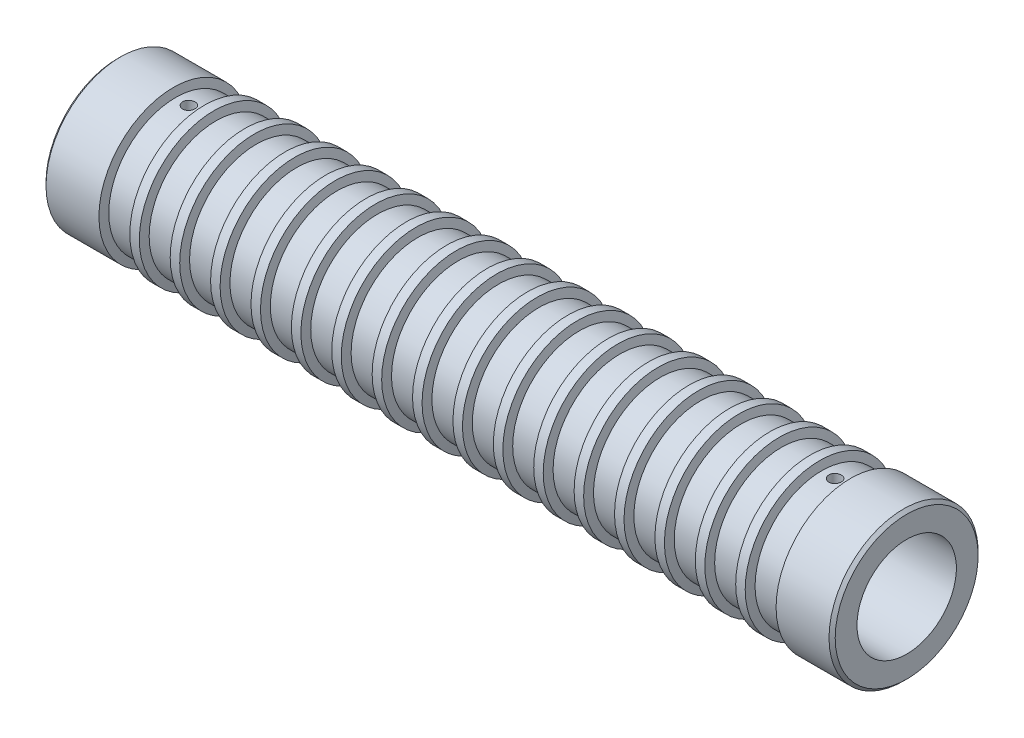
SolidWorks part; units mm, degrees
ref_plane "Ebene1" through (0, 0, 0) normal (0, 0, 1) x (1, 0, 0)
ref_plane "Ebene2" through (0, 0, 0) normal (0, 1, 0) x (1, 0, 0)
ref_plane "Ebene3" through (0, 0, 0) normal (1, 0, 0) x (0, 0, -1)
sketch "Skizze1" plane through (0, 0, 0) normal (0, 0, 1) x (1, 0, 0)
  line L0 (-63.5, 0) -> (63.5, 0) construction
  line L1 (-63, 12) -> (-63.5, 11.5)
  line L2 (54.15, 10.75) -> (49.85, 10.75)
  line L3 (-47.5, 8) -> (-47.5, 7.5)
  line L4 (-47.5, 7.5) -> (47.5, 7.5)
  line L5 (47.5, 7.5) -> (47.5, 8)
  line L6 (-47.9849, 12) -> (-47.65, 10.75)
  line L7 (0, 0) -> (0, 33.3198) construction
  line L10 (63.5, 8) -> (63.5, 11.5)
  line L11 (-63.5, 8) -> (-63.5, 11.5)
  line L12 (54.4849, 12) -> (63, 12)
  line L13 (54.4849, 12) -> (54.15, 10.75)
  line L14 (49.5151, 12) -> (49.85, 10.75)
  line L15 (52, 33.3198) -> (52, 10.75) construction
  line L16 (49.5151, 12) -> (47.9849, 12)
  line L17 (41.4849, 12) -> (41.15, 10.75)
  line L18 (36.5151, 12) -> (36.85, 10.75)
  line L19 (39, 33.3198) -> (39, 10.75) construction
  line L20 (41.15, 10.75) -> (36.85, 10.75)
  line L21 (36.5151, 12) -> (34.9849, 12)
  line L22 (-26, 10.75) -> (-26, 33.3198) construction
  line L23 (28.4849, 12) -> (28.15, 10.75)
  line L24 (23.5151, 12) -> (23.85, 10.75)
  line L25 (26, 33.3198) -> (26, 10.75) construction
  line L26 (28.15, 10.75) -> (23.85, 10.75)
  line L27 (23.5151, 12) -> (21.9849, 12)
  line L29 (63, 12) -> (63.5, 11.5)
  line L30 (-2.4849, 12) -> (-2.15, 10.75)
  line L31 (-2.15, 10.75) -> (2.15, 10.75)
  line L32 (10.5151, 12) -> (8.9849, 12)
  line L33 (-54.4849, 12) -> (-54.15, 10.75)
  line L34 (-54.15, 10.75) -> (-49.85, 10.75)
  line L35 (-49.5151, 12) -> (-49.85, 10.75)
  line L36 (-41.4849, 12) -> (-41.15, 10.75)
  line L37 (-41.15, 10.75) -> (-36.85, 10.75)
  line L38 (-36.5151, 12) -> (-36.85, 10.75)
  line L39 (-28.4849, 12) -> (-28.15, 10.75)
  line L40 (-28.15, 10.75) -> (-23.85, 10.75)
  line L41 (-23.5151, 12) -> (-23.85, 10.75)
  line L42 (2.15, 10.75) -> (2.4849, 12)
  line L43 (-28.4849, 12) -> (-30.0151, 12)
  line L44 (-41.4849, 12) -> (-43.0151, 12)
  line L45 (-54.4849, 12) -> (-63, 12)
  line L46 (-39, 10.75) -> (-39, 33.3198) construction
  line L47 (-52, 10.75) -> (-52, 33.3198) construction
  line L49 (-63.5, 8) -> (-47.5, 8)
  line L59 (47.5, 8) -> (63.5, 8)
  line L60 (-47.65, 10.75) -> (-43.35, 10.75)
  line L62 (-43.35, 10.75) -> (-43.0151, 12)
  line L63 (-34.9849, 12) -> (-34.65, 10.75)
  line L64 (-34.65, 10.75) -> (-30.35, 10.75)
  line L65 (-30.35, 10.75) -> (-30.0151, 12)
  line L66 (13, 33.3198) -> (13, 10.75) construction
  line L67 (-21.9849, 12) -> (-21.65, 10.75)
  line L68 (-21.65, 10.75) -> (-17.35, 10.75)
  line L69 (-17.35, 10.75) -> (-17.0151, 12)
  line L70 (-8.9849, 12) -> (-8.65, 10.75)
  line L71 (-8.65, 10.75) -> (-4.35, 10.75)
  line L72 (10.5151, 12) -> (10.85, 10.75)
  line L73 (10.85, 10.75) -> (15.15, 10.75)
  line L74 (15.4849, 12) -> (15.15, 10.75)
  line L75 (-13, 33.3198) -> (-13, 10.75) construction
  line L76 (-4.35, 10.75) -> (-4.0151, 12)
  line L77 (4.0151, 12) -> (4.35, 10.75)
  line L78 (4.35, 10.75) -> (8.65, 10.75)
  line L79 (8.65, 10.75) -> (8.9849, 12)
  line L80 (-10.5151, 12) -> (-10.85, 10.75)
  line L81 (-10.85, 10.75) -> (-15.15, 10.75)
  line L82 (-15.4849, 12) -> (-15.15, 10.75)
  line L83 (-2.4849, 12) -> (-4.0151, 12)
  line L84 (-15.4849, 12) -> (-17.0151, 12)
  line L85 (17.0151, 12) -> (17.35, 10.75)
  line L90 (17.35, 10.75) -> (21.65, 10.75)
  line L91 (21.65, 10.75) -> (21.9849, 12)
  line L92 (30.0151, 12) -> (30.35, 10.75)
  line L93 (30.35, 10.75) -> (34.65, 10.75)
  line L94 (34.65, 10.75) -> (34.9849, 12)
  line L95 (43.0151, 12) -> (43.35, 10.75)
  line L96 (43.35, 10.75) -> (47.65, 10.75)
  line L97 (47.65, 10.75) -> (47.9849, 12)
  line L98 (45.5, 10.75) -> (45.5, 33.3198) construction
  line L99 (32.5, 10.75) -> (32.5, 33.3198) construction
  line L100 (19.5, 10.75) -> (19.5, 33.3198) construction
  line L101 (6.5, 10.75) -> (6.5, 33.3198) construction
  line L102 (-6.5, 10.75) -> (-6.5, 33.3198) construction
  line L103 (-19.5, 10.75) -> (-19.5, 33.3198) construction
  line L104 (-32.5, 10.75) -> (-32.5, 33.3198) construction
  line L105 (-45.5, 10.75) -> (-45.5, 33.3198) construction
  line L106 (43.0151, 12) -> (41.4849, 12)
  line L107 (30.0151, 12) -> (28.4849, 12)
  line L108 (17.0151, 12) -> (15.4849, 12)
  line L109 (4.0151, 12) -> (2.4849, 12)
  line L110 (-8.9849, 12) -> (-10.5151, 12)
  line L111 (-21.9849, 12) -> (-23.5151, 12)
  line L112 (-34.9849, 12) -> (-36.5151, 12)
  line L113 (-47.9849, 12) -> (-49.5151, 12)
  line L114 (-52, 33.3198) -> (-45.5, 33.3198) construction
  line L115 (-45.5, 33.3198) -> (-39, 33.3198) construction
  line L116 (-39, 33.3198) -> (-32.5, 33.3198) construction
  line L117 (-32.5, 33.3198) -> (-26, 33.3198) construction
  line L118 (-26, 33.3198) -> (-19.5, 33.3198) construction
  line L119 (-19.5, 33.3198) -> (-13, 33.3198) construction
  line L120 (-13, 33.3198) -> (-6.5, 33.3198) construction
  line L121 (-6.5, 33.3198) -> (0, 33.3198) construction
  line L122 (0, 33.3198) -> (6.5, 33.3198) construction
  line L123 (6.5, 33.3198) -> (13, 33.3198) construction
  line L124 (13, 33.3198) -> (19.5, 33.3198) construction
  line L125 (19.5, 33.3198) -> (26, 33.3198) construction
  line L126 (26, 33.3198) -> (32.5, 33.3198) construction
  line L127 (32.5, 33.3198) -> (39, 33.3198) construction
  line L128 (39, 33.3198) -> (45.5, 33.3198) construction
  line L129 (45.5, 33.3198) -> (52, 33.3198) construction
  point P10 (-63.5, 12)
  point P14 (63.5, 12)
  point P35 (63.5, 12)
  point P67 (63.5, 12)
  dimension "D6" = 127
  dimension "D7" = 24
  dimension "D8" = 16
  dimension "D9" = 21.5
  dimension "D10" = 11.5
  dimension "D11" = 13
  dimension "D12" = 6.5
  dimension "D13" = 24.5
  dimension "D14" = 37.5
  dimension "D15" = 104
  dimension "D19" = 76.5
  dimension "D25" = 15
  dimension "D27" = 50.5
  dimension "D30" = 63.5
  dimension "D37" = 89.5
  dimension "D38" = 102.5
  dimension "D39" = 115.5
  dimension "D42" = 30
  dimension "D47" = 18
  dimension "D48" = 11.5
  dimension "D50" = 31
  dimension "D54" = 4.3
  dimension "D55" = 44
  dimension "D56" = 57
  dimension "D57" = 70
  dimension "D58" = 83
  dimension "D59" = 96
  dimension "D60" = 109
  dimension "D61" = 16
revolve "Basis-Rotation" add sketch "Skizze1" angle 360 about L0
ref_plane "Ebene4" through (-42.25, 12, 0) normal (0, 1, 0) x (0, 0, -1)
hole_wizard "Ø2.0 (2) Durchmesser Bohrung2" positions "Skizze3" profile "Skizze2" hole size "Ø2.0" standard "DIN"
sketch "Skizze3" plane through (-42.25, 12, 0) normal (0, 1, 0) x (0, 0, -1)
  line L0 (-11.5, -105.75) -> (11.5, -105.75) construction
  line L4 (0, 9.75) -> (0, -42.25) construction
  line L5 (0, -42.25) -> (0, -94.25) construction
  point P0 (0, -94.25)
  point P1 (0, 9.75)
  dimension "D1" = 11.5
  dimension "D2" = 115.5
sketch "Skizze2" plane through (52, 12, 0) normal (1, 0, 0) x (0, 0, 1)
  line L0 (0, 0) -> (0, 4)
  line L1 (0, 4) -> (1, 4)
  line L2 (1, 4) -> (1, 0)
  line L5 (1, 0) -> (0, 0)
  line L11 (0, -6.35) -> (0, 107.95) construction
  dimension "Bohrerdurchmesser" = 2
  dimension "Bohrungstiefe" = 4
